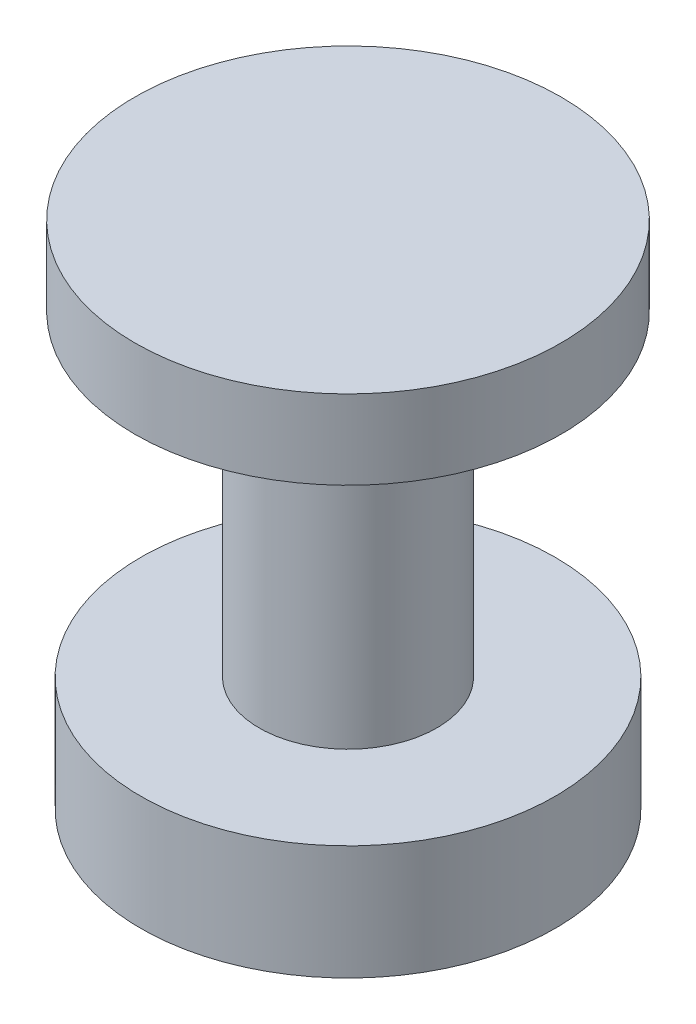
SolidWorks part; units mm, degrees
ref_plane "Plane1" through (0, 0, 0) normal (0, 0, 1) x (1, 0, 0)
ref_plane "Plane2" through (0, 0, 0) normal (0, 1, 0) x (1, 0, 0)
ref_plane "Plane3" through (0, 0, 0) normal (1, 0, 0) x (0, 0, -1)
sketch "Sketch2" plane through (0, 0, 0) normal (0, 0, 1) x (1, 0, 0)
  line L0 (0, 32.2657) -> (13.4791, 32.2657)
  line L1 (13.4791, 32.2657) -> (13.4791, 27.2609)
  line L2 (13.4791, 27.2609) -> (5.6177, 27.2609)
  line L3 (5.6177, 27.2609) -> (5.6177, 7.2416)
  line L4 (5.6177, 7.2416) -> (13.1012, 7.2416)
  line L5 (13.1012, 7.2416) -> (13.1012, 0)
  line L6 (13.1012, 0) -> (0, 0)
  line L7 (0, 0) -> (0, 32.2657)
  line L8 (0, 0) -> (0, 63.7667) construction
revolve "Base-Revolve" add sketch "Sketch2" angle 360 about L8
